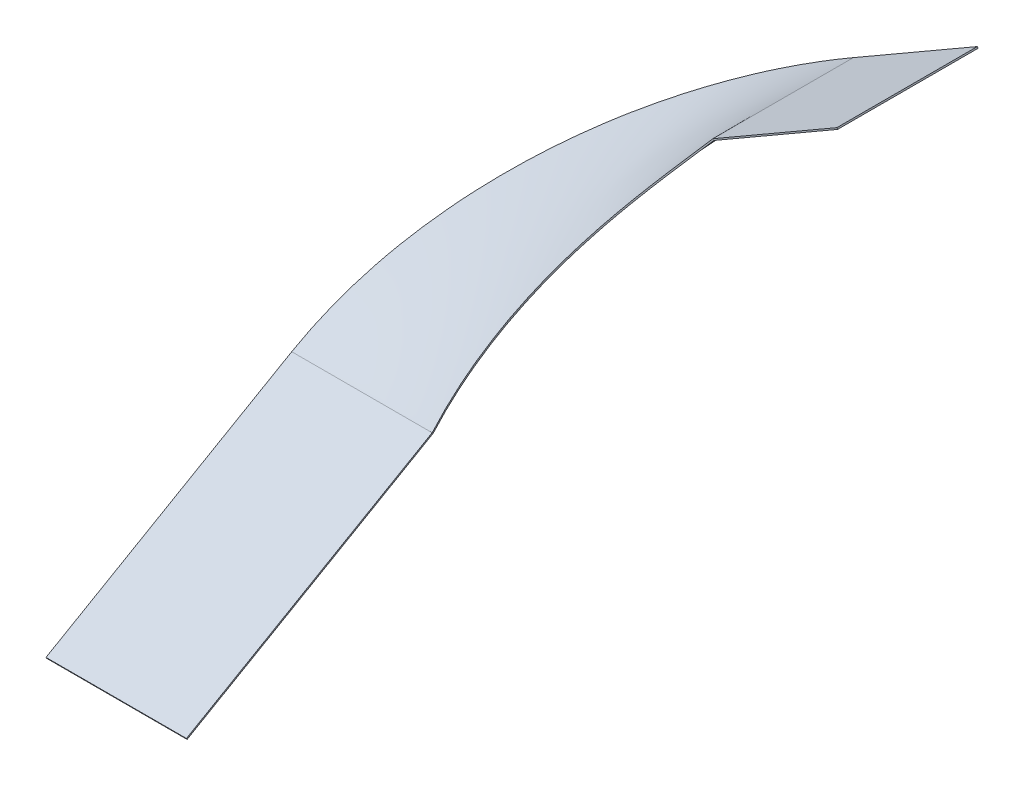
SolidWorks part; units mm, degrees
ref_plane "Vorne" through (0, 0, 0) normal (0, 0, 1) x (1, 0, 0)
ref_plane "Oben" through (0, 0, 0) normal (0, 1, 0) x (1, 0, 0)
ref_plane "Rechts" through (0, 0, 0) normal (1, 0, 0) x (0, 0, -1)
sketch "Skizze1" plane through (0, 0, 0) normal (0, 1, 0) x (1, 0, 0)
  circle A0 centre (0, 0) radius 200
  dimension "D1" = 400
sketch "Skizze2" plane through (0, 0, 0) normal (0, 1, 0) x (1, 0, 0)
  circle A0 centre (0, 0) radius 400
  circle A1 centre (0, 0) radius 200 construction
  dimension "D1" = 200
  dimension "D2" = 800
curve "Spirale/Helix1"
curve "Spirale/Helix2"
sketch3d "3D-Skizze1"
  line L0 (0, 362.75, -400) -> (176.5, 464.6495, -400)
  line L1 (-400, 0, 0) -> (-400, -202.0671, 350)
  line L2 (-400, 0, 0) -> (-400, -294.0028, 0) construction
  line L3 (0, 362.75, -400) -> (0, 146.3528, -400) construction
  spline S1 degree 3 poles (1212.2022, -523.3086, -547.7888) (94.1681, -425.6236, 772.7641) (-437.5045, -199.3411, 343.5411) (-396.5826, 31.5434, -54.5089) (-391.9382, 47.3152, -81.4457) (-385.4665, 63.0869, -108.0026) (-377.1975, 78.8587, -134.056) (-367.1698, 94.6304, -159.4844) (-355.4303, 110.4022, -184.1691) (-342.0335, 126.1739, -207.9952) (-327.0421, 141.9457, -230.8515) (-310.5258, 157.7174, -252.6315) (-292.5617, 173.4891, -273.2336) (-273.2336, 189.2609, -292.5617) (-252.6315, 205.0326, -310.5258) (-230.8515, 220.8043, -327.0421) (-207.9952, 236.5761, -342.0335) (-184.1691, 252.3478, -355.4303) (-159.4844, 268.1196, -367.1698) (-134.056, 283.8913, -377.1975) (-108.0026, 299.6631, -385.4665) (-81.4457, 315.4348, -391.9382) (-54.5089, 331.2066, -396.5826) (343.5424, 562.0919, -437.5046) (772.7669, 788.3751, 94.1716) (-547.8022, 886.0596, 1212.2136) knots -1.779071 -1.779071 -1.779071 -1.779071 0.043478 0.086957 0.130435 0.173913 0.217391 0.26087 0.304348 0.347826 0.391304 0.434783 0.478261 0.521739 0.565217 0.608696 0.652174 0.695652 0.73913 0.782609 0.826087 0.869565 0.913043 0.956522 2.779078 2.779078 2.779078 2.779078 only from (-400, 0, 0) to (0, 362.75, -400)
  spline S2 degree 3 poles (-400, 0, 0) (-400, 5.2565, -9.1047) (-399.3779, 15.7721, -27.3188) (-396.5826, 31.5434, -54.5089) (-391.9382, 47.3152, -81.4457) (-385.4665, 63.0869, -108.0026) (-377.1975, 78.8587, -134.056) (-367.1698, 94.6304, -159.4844) (-355.4303, 110.4022, -184.1691) (-342.0335, 126.1739, -207.9952) (-327.0421, 141.9457, -230.8515) (-310.5258, 157.7174, -252.6315) (-292.5617, 173.4891, -273.2336) (-273.2336, 189.2609, -292.5617) (-252.6315, 205.0326, -310.5258) (-230.8515, 220.8043, -327.0421) (-207.9952, 236.5761, -342.0335) (-184.1691, 252.3478, -355.4303) (-159.4844, 268.1196, -367.1698) (-134.056, 283.8913, -377.1975) (-108.0026, 299.6631, -385.4665) (-81.4457, 315.4348, -391.9382) (-54.5089, 331.2066, -396.5826) (-27.3188, 346.9779, -399.3779) (-9.1047, 357.4935, -400) (0, 362.75, -400) knots 0 0 0 0 0.043478 0.086957 0.130435 0.173913 0.217391 0.26087 0.304348 0.347826 0.391304 0.434783 0.478261 0.521739 0.565217 0.608696 0.652174 0.695652 0.73913 0.782609 0.826087 0.869565 0.913043 0.956522 1 1 1 1
  dimension "D2" = 176.5
  dimension "D3" = 350
  dimension "D1" = 0
sketch3d "3D-Skizze2"
  line L0 (0, 362.75, -200) -> (176.5, 464.6495, -200)
  line L1 (0, 362.75, -400) -> (176.5, 464.6495, -400) construction
  line L2 (-200, 0, 0) -> (-200, -202.0671, 350)
  line L3 (-400, 0, 0) -> (-400, -202.0671, 350) construction
  line L5 (0, 362.75, -200) -> (0, 77.4335, -200) construction
  line L6 (-200, 0, 0) -> (-200, -442.0384, 0) construction
  spline S1 degree 3 poles (1188.7227, -686.6288, -1005.9434) (219.2817, -554.1054, 516.2849) (-229.5495, -260.7616, 224.1766) (-197.4971, 38.1841, -32.9564) (-194.101, 57.2763, -49.1531) (-189.3791, 76.3684, -65.0139) (-183.3634, 95.4605, -80.4307) (-176.0952, 114.5526, -95.298) (-167.6241, 133.6447, -109.5143) (-158.008, 152.7368, -122.9826) (-147.3125, 171.8289, -135.6107) (-135.6107, 190.9211, -147.3125) (-122.9826, 210.0132, -158.008) (-109.5143, 229.1053, -167.6241) (-95.298, 248.1974, -176.0952) (-80.4307, 267.2895, -183.3634) (-65.0139, 286.3816, -189.3791) (-49.1531, 305.4737, -194.101) (-32.9564, 324.5659, -197.4971) (224.1728, 623.5071, -229.549) (516.2759, 916.8463, 219.2679) (-1005.8716, 1049.3725, 1188.6769) knots -2.314493 -2.314493 -2.314493 -2.314493 0.052632 0.105263 0.157895 0.210526 0.263158 0.315789 0.368421 0.421053 0.473684 0.526316 0.578947 0.631579 0.684211 0.736842 0.789474 0.842105 0.894737 0.947368 3.314456 3.314456 3.314456 3.314456 only from (-200, 0, 0) to (0, 362.75, -200)
  spline S2 degree 3 poles (-200, 0, 0) (-200, 6.3633, -5.5109) (-199.5441, 19.0925, -16.535) (-197.4971, 38.1841, -32.9564) (-194.101, 57.2763, -49.1531) (-189.3791, 76.3684, -65.0139) (-183.3634, 95.4605, -80.4307) (-176.0952, 114.5526, -95.298) (-167.6241, 133.6447, -109.5143) (-158.008, 152.7368, -122.9826) (-147.3125, 171.8289, -135.6107) (-135.6107, 190.9211, -147.3125) (-122.9826, 210.0132, -158.008) (-109.5143, 229.1053, -167.6241) (-95.298, 248.1974, -176.0952) (-80.4307, 267.2895, -183.3634) (-65.0139, 286.3816, -189.3791) (-49.1531, 305.4737, -194.101) (-32.9564, 324.5659, -197.4971) (-16.535, 343.6575, -199.5441) (-5.5109, 356.3867, -200) (0, 362.75, -200) knots 0 0 0 0 0.052632 0.105263 0.157895 0.210526 0.263158 0.315789 0.368421 0.421053 0.473684 0.526316 0.578947 0.631579 0.684211 0.736842 0.789474 0.842105 0.894737 0.947368 1 1 1 1
  dimension "D2" = 176.5
  dimension "D3" = 350
  dimension "D1" = 0
sheet metal parameters "Blech1" thickness 2 parameters "D1"=1.5, "Dicke"=2
lofted bend "Ausgeformte Biegungen1" parameters "D1"=0, "D12"=2
other "Freiform-Biegung3" parameters "D1"=1000, "D4"=57.296, "D5"=1
flat pattern "Abwicklung1"
sketch "Biegung-Linien1" plane through (0, 0, 0) normal (0, 0.7924, 0.61) x (-1, 0, 0)
  line L0 (400, 0) -> (200, 0) construction
  line L1 (398.2461, -45.172) -> (198.835, -29.8347) construction
  line L2 (393.0306, -90.1185) -> (195.3829, -59.5346) construction
  line L3 (384.3832, -134.5329) -> (189.6632, -88.8823) construction
  line L4 (372.3568, -178.1535) -> (181.7106, -117.7051) construction
  line L5 (357.0201, -220.7234) -> (171.5711, -145.8333) construction
  line L6 (338.4646, -261.9919) -> (159.3043, -173.1009) construction
  line L7 (316.7976, -301.7153) -> (144.982, -199.3473) construction
  line L8 (292.1498, -339.6611) -> (128.6899, -224.4185) construction
  line L9 (264.6639, -375.6046) -> (110.5231, -248.1666) construction
  line L10 (234.5031, -409.3348) -> (90.5886, -270.4514) construction
  line L11 (201.8434, -440.6518) -> (69.0033, -291.1415) construction
  line L12 (166.8795, -469.3732) -> (45.8956, -310.1159) construction
  line L13 (129.8156, -495.3284) -> (21.4008, -327.2626) construction
  line L14 (90.8706, -518.3651) -> (-4.3369, -342.4801) construction
  line L15 (50.2737, -538.3471) -> (-31.1658, -355.679) construction
  line L16 (8.145, -555.2044) -> (-59.0464, -366.8289) construction
other "Abwickeln-<Freiform-Biegung3>1"
equation "\"D2@3D-Skizze2\" = \"D2@3D-Skizze1\""
equation "\"D3@3D-Skizze2\" = \"D3@3D-Skizze1\""
